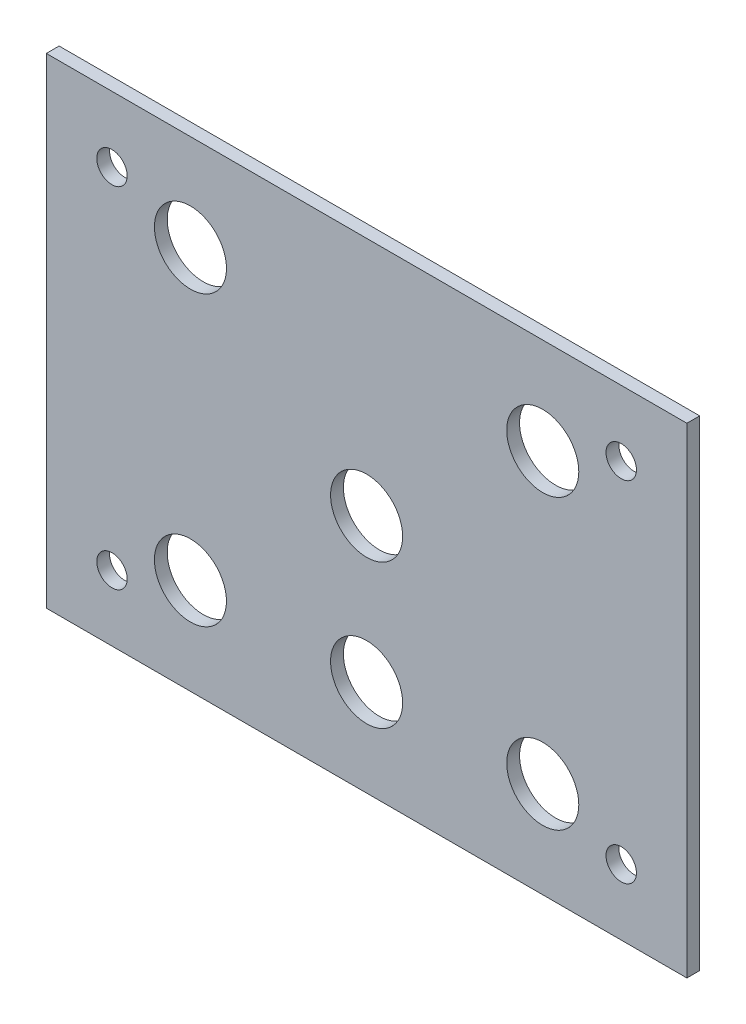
SolidWorks part; units mm, degrees
ref_plane "Plan de face" through (0, 0, 0) normal (0, 0, 1) x (1, 0, 0)
ref_plane "Plan de dessus" through (0, 0, 0) normal (0, 1, 0) x (1, 0, 0)
ref_plane "Plan de droite" through (0, 0, 0) normal (1, 0, 0) x (0, 0, -1)
sketch "Esquisse1" plane through (0, 0, 0) normal (0, 0, 1) x (1, 0, 0)
  line L1 (0, 0) -> (200, 0)
  line L2 (0, 0) -> (0, 150)
  line L3 (0, 150) -> (200, 150)
  line L4 (200, 0) -> (200, 150)
  dimension "D1" = 150
  dimension "D2" = 200
extrude "facade" add sketch "Esquisse1" along normal blind 4
sketch "Esquisse4" plane through (0, 0, 0) normal (0, 0, 1) x (1, 0, 0)
  line L0 (0, 150) -> (0, 0) construction
  line L2 (200, 150) -> (0, 150) construction
  circle A0 centre (20.5, 129.5) radius 4.75
  circle A1 centre (179.5, 20.5) radius 4.75
  circle A2 centre (179.5, 129.5) radius 4.75
  circle A3 centre (20.5, 20.5) radius 4.75
  dimension "D1" = 9.5
  dimension "D4" = 20.5
  dimension "D2" = 159
  dimension "D3" = 109
  dimension "D5" = 20.5
extrude "trous de fixation" cut sketch "Esquisse4" along normal through all
sketch "Face_AV_boutons" plane through (0, 0, 4) normal (0, 0, 1) x (1, 0, 0)
  line L0 (200, 150) -> (0, 150) construction
  line L1 (0, 150) -> (0, 0) construction
  circle A0 centre (45, 120) radius 11.25
  circle A1 centre (155, 120) radius 11.25
  circle A2 centre (100, 30) radius 11.25
  circle A3 centre (45, 30) radius 11.25
  circle A4 centre (100, 75) radius 11.25
  circle A5 centre (155, 30) radius 11.25
  dimension "D1" = 30
  dimension "D2" = 22.5
  dimension "D4" = 45
  dimension "D3" = 100
  dimension "D5" = 155
  dimension "D6" = 75
  dimension "D12" = 120
  dimension "D13" = 45
  dimension "D14" = 155
extrude "percage trous" cut sketch "Face_AV_boutons" against normal through all
sketch "TExte" plane through (0, 0, 0) normal (0, 0, -1) x (-1, 0, 0)
  text T0 "ARU"
  text T1 "MARCHE SH"
  text T2 "MARCHE SAH"
  text T3 "ARRET"
  text T4 "BP SH"
  text T5 "BP SAH"
